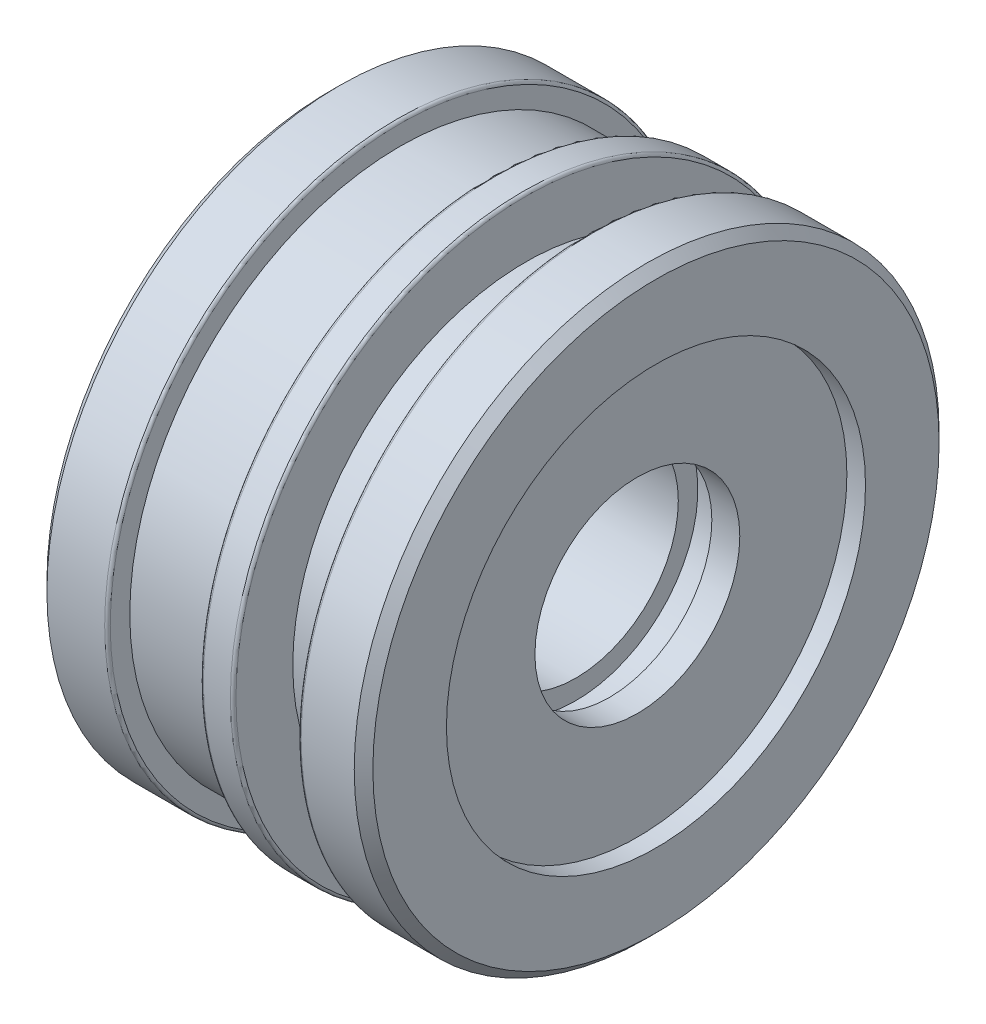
SolidWorks part; units mm, degrees
ref_plane "Plan de face" through (0, 0, 0) normal (0, 0, 1) x (1, 0, 0)
ref_plane "Plan de dessus" through (0, 0, 0) normal (0, 1, 0) x (1, 0, 0)
ref_plane "Plan de droite" through (0, 0, 0) normal (1, 0, 0) x (0, 0, -1)
sketch "Esquisse1" plane through (0, 0, 0) normal (0, 0, 1) x (1, 0, 0)
  line L0 (0, 0) -> (37.4121, 0) construction
  line L1 (0, 15) -> (0, 31.4)
  line L2 (0, 31.4) -> (7.5, 31.4)
  line L3 (7.5, 31.4) -> (7.5, 29)
  line L4 (7.5, 29) -> (17.5, 29)
  line L5 (17.5, 29) -> (17.5, 31.4)
  line L6 (17.5, 31.4) -> (21, 31.4)
  line L7 (21, 31.4) -> (21, 25)
  line L8 (21, 25) -> (28, 25)
  line L9 (28, 25) -> (28, 31.4)
  line L10 (28, 31.4) -> (35, 31.4)
  line L11 (35, 31.4) -> (35, 22.5)
  line L12 (35, 22.5) -> (33, 22.5)
  line L13 (33, 22.5) -> (33, 11)
  line L14 (33, 11) -> (30, 11)
  line L15 (30, 11) -> (30, 13.1)
  line L16 (30, 13.1) -> (26.4, 13.1)
  line L17 (26.4, 13.1) -> (26.4, 11)
  line L18 (26.4, 11) -> (6.5, 11)
  line L19 (6.5, 11) -> (6.5, 15)
  line L20 (6.5, 15) -> (0, 15)
  dimension "D1" = 22
  dimension "D2" = 26.2
  dimension "D3" = 45
  dimension "D4" = 30
  dimension "D5" = 6.5
  dimension "D6" = 35
  dimension "D7" = 62.8
  dimension "D8" = 58
  dimension "D9" = 50
  dimension "D10" = 17.5
  dimension "D11" = 10
  dimension "D12" = 7
  dimension "D13" = 7
  dimension "D14" = 2
  dimension "D15" = 5
  dimension "D16" = 3.6
revolve "Révolution1" add sketch "Esquisse1" angle 360 about L0
chamfer "Chanfrein1" distance 1 angle 45 2 edges at (0, 0, 31.4) (35, 0, 31.4)
fillet "Congé1" radius 0.3 4 edges at (17.5, 0, 31.4) (28, 0, 31.4) (21, 0, 31.4) (7.5, 0, 31.4)
